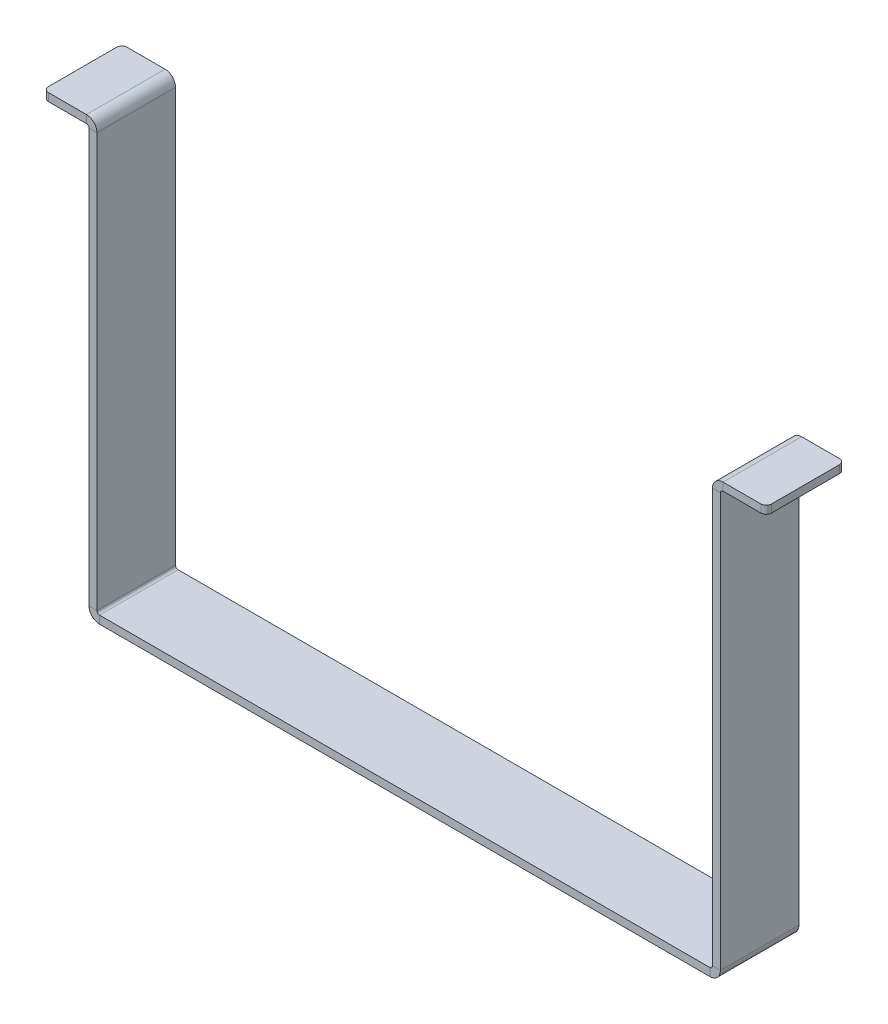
SolidWorks part; units mm, degrees
ref_plane "Plan1" through (0, 0, 0) normal (0, 0, 1) x (1, 0, 0)
ref_plane "Plan2" through (0, 0, 0) normal (0, 1, 0) x (1, 0, 0)
ref_plane "Plan3" through (0, 0, 0) normal (1, 0, 0) x (0, 0, -1)
sketch "Esquisse1" plane through (0, 0, 0) normal (0, 0, 1) x (1, 0, 0)
  line L0 (-138, 0) -> (-117.5, 0)
  line L1 (-117.5, 0) -> (-117.5, -163)
  line L2 (-117.5, -163) -> (117.5, -163)
  line L3 (117.5, -163) -> (117.5, 0)
  line L4 (117.5, 0) -> (138, 0)
  line L5 (0, 20) -> (0, -20) construction
  dimension "D1" = 276
  dimension "D3" = 163
  dimension "D4" = 235
extrude "Base-Extru.-Mince" add sketch "Esquisse1" along normal mid plane 30 thin
fillet "Congé1" radius 2
sheet metal parameters "Tôlerie 1" parameters "D1"=1
bend "Pli dans angle3" parameters "D1"=0
flatten bends "Dépliage 1" parameters "D1"=0, "D4"=90, "D5"=1
sketch "Esquisse-Angle1" plane through (-117.5, 0, 0) normal (1, 0, 0) x (0, 0, -1)
  line L0 (-15, -163) -> (15, -163) construction
  line L1 (-15, -398) -> (15, -398) construction
  line L2 (-15, -3) -> (15, -3) construction
  line L3 (15, -558) -> (-15, -558) construction
bend "Pli dans angle1" bend angle 90 parameters "D1"=0, "D5"=4
bend "Pli dans angle2" bend angle 90 parameters "D1"=0, "D5"=3
bend "Pli dans angle4" bend angle 90 parameters "D1"=0, "D5"=2
process bends "Pliage 1" parameters "D1"=0
sketch "Esquisse-Plate1" plane through (-117.5, 0, 0) normal (1, 0, 0) x (0, 0, -1)
